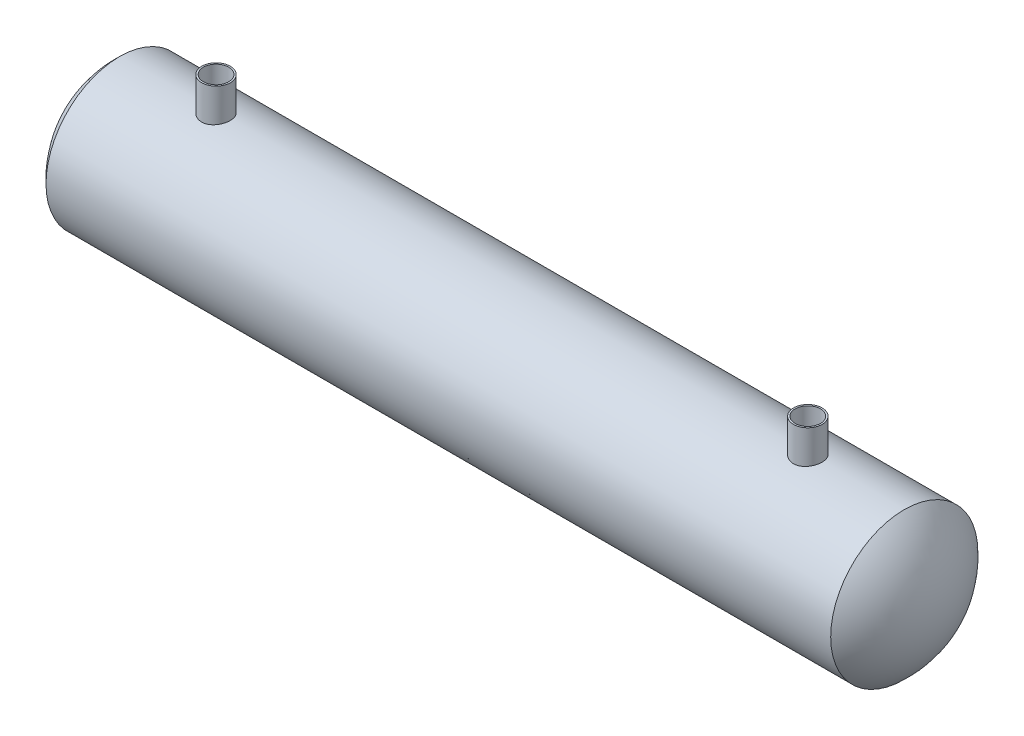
SolidWorks part; units mm, degrees
ref_plane "Alzado" through (0, 0, 0) normal (0, 0, 1) x (1, 0, 0)
ref_plane "Planta" through (0, 0, 0) normal (0, 1, 0) x (1, 0, 0)
ref_plane "Vista lateral" through (0, 0, 0) normal (1, 0, 0) x (0, 0, -1)
sketch "Croquis2" plane through (0, 0, 0) normal (0, 1, 0) x (1, 0, 0)
  line L0 (-104.8461, 0) -> (-101.8461, 0)
  line L1 (-64.8461, 90) -> (895.1539, 90)
  line L2 (935.1539, 0) -> (932.1539, 0)
  line L3 (-64.8461, 87) -> (895.1539, 87)
  line L4 (-104.8461, 0) -> (935.1539, 0) construction
  arc A0 (-104.8461, 0) -> (-64.8461, 90) centre (16.4039, 0) cw
  arc A1 (935.1539, 0) -> (895.1539, 90) centre (813.9039, 0) ccw
  arc A2 (-101.8461, 0) -> (-64.8461, 87) centre (18.9377, 0) cw
  arc A3 (932.1539, 0) -> (895.1539, 87) centre (811.3701, 0) ccw
  dimension "D1" = 1040
  dimension "D2" = 3
  dimension "D3" = 40
  dimension "D4" = 40
  dimension "D5" = 3
  dimension "D6" = 3
revolve "Revolución1" add sketch "Croquis2" angle 360 about L4
sketch "Croquis3" plane through (0, 0, 0) normal (0, 1, 0) x (1, 0, 0)
  line L0 (-64.8461, -90) -> (-64.8461, 90) construction
  line L1 (895.1539, -90) -> (895.1539, 90) construction
  circle A0 centre (53.1539, 0) radius 15.5
  circle A1 centre (777.1539, 0) radius 15.5
  dimension "D1" = 31
  dimension "D2" = 31
  dimension "D3" = 118
  dimension "D4" = 118
extrude "Cortar-Extruir1" cut sketch "Croquis3" along normal blind 160
ref_plane "Plano1" through (0, 80, 0) normal (0, 1, 0) x (-1, 0, 0)
sketch "Croquis4" plane through (0, 80, 0) normal (0, 1, 0) x (-1, 0, 0)
  circle A0 centre (-777.1539, 0) radius 17.5
  circle A1 centre (-777.1539, 0) radius 15.5
  circle A2 centre (-53.1539, 0) radius 15.5
  circle A3 centre (-53.1539, 0) radius 17.5
  dimension "D1" = 35
  dimension "D2" = 35
extrude "Saliente-Extruir1" add sketch "Croquis4" along normal blind 50
